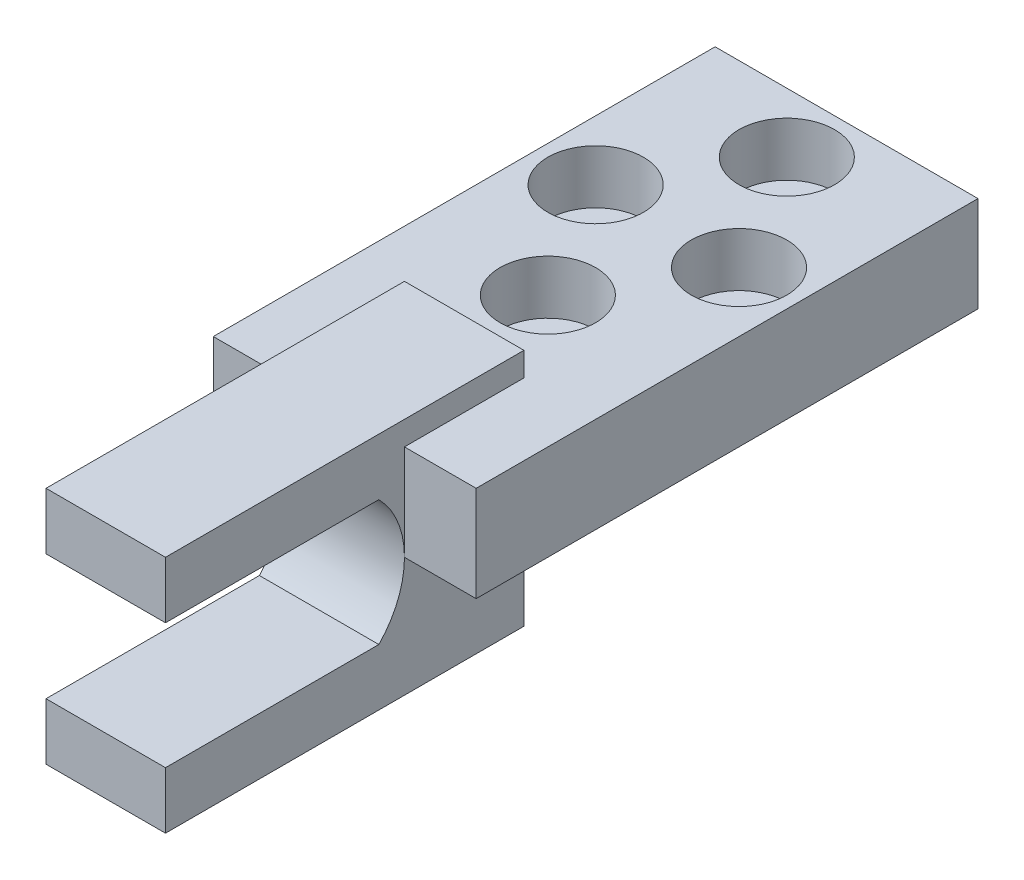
SolidWorks part; units mm, degrees
ref_plane "前视基准面" through (0, 0, 0) normal (0, 0, 1) x (1, 0, 0)
ref_plane "上视基准面" through (0, 0, 0) normal (0, 1, 0) x (1, 0, 0)
ref_plane "右视基准面" through (0, 0, 0) normal (1, 0, 0) x (0, 0, -1)
sketch "草图1" plane through (0, 0, 0) normal (0, 0, 1) x (1, 0, 0)
  line L0 (6, 0) -> (6, 10)
  line L1 (16, 0) -> (16, 10)
  line L2 (6, 20) -> (16, 20)
  line L3 (6, 0) -> (16, 0)
  line L4 (0, 10) -> (0, 18)
  line L5 (22, 10) -> (22, 18)
  line L6 (16, 10) -> (22, 10)
  line L7 (6, 10) -> (0, 10)
  line L8 (0, 18) -> (6, 18)
  line L9 (16, 18) -> (16, 20)
  line L10 (6, 18) -> (6, 20)
  line L11 (16, 18) -> (22, 18)
extrude "凸台-拉伸1" add sketch "草图1" along normal blind 62
sketch "草图2" plane through (22, 0, 0) normal (1, 0, 0) x (0, 0, -1)
  line L0 (0, 10) -> (0, 18)
  line L1 (-62, 0) -> (-62, 4.75)
  line L2 (-62, 20) -> (-32, 20)
  line L3 (-32, 10) -> (0, 10)
  line L4 (-62, 0) -> (-32, 0)
  line L5 (-32, 0) -> (-32, 10)
  line L6 (-62, 15.25) -> (-44.1439, 15.25)
  line L7 (-62, 4.75) -> (-44.1439, 4.75)
  line L8 (-62, 15.25) -> (-62, 20)
  line L9 (-32, 18) -> (0, 18)
  line L10 (-32, 18) -> (-32, 20)
  arc A0 (-44.1439, 4.75) -> (-44.1439, 15.25) centre (-49.5, 10) ccw
extrude "切除-拉伸1" cut sketch "草图2" against normal blind 62 flip side to cut
sketch "草图3" plane through (0, 18, 0) normal (0, 1, 0) x (1, 0, 0)
  circle A0 centre (11, -5) radius 2.25
  circle A1 centre (11, -25) radius 2.25
  circle A2 centre (5, -15) radius 2.25
  circle A3 centre (17, -15) radius 2.25
extrude "切除-拉伸2" cut sketch "草图3" against normal blind 62
sketch "草图4" plane through (0, 18, 0) normal (0, 1, 0) x (1, 0, 0)
  circle A0 centre (11, -5) radius 4
  circle A1 centre (11, -25) radius 4
  circle A2 centre (5, -15) radius 4
  circle A3 centre (17, -15) radius 4
extrude "切除-拉伸3" cut sketch "草图4" against normal blind 4.5
sketch "草图5" plane through (0, 0, 0) normal (0, -1, 0) x (1, 0, 0)
  line L1 (-0.874, 63.2101) -> (6, 63.2101)
  line L2 (-0.874, 63.2101) -> (-0.874, 42)
  line L3 (-0.874, 42) -> (6, 42)
  line L4 (6, 63.2101) -> (6, 42)
  line L5 (24.2709, 63.2101) -> (16, 63.2101)
  line L6 (24.2709, 63.2101) -> (24.2709, 42)
  line L7 (24.2709, 42) -> (16, 42)
  line L8 (16, 63.2101) -> (16, 42)
extrude "切除-拉伸4" cut sketch "草图5" against normal through all
